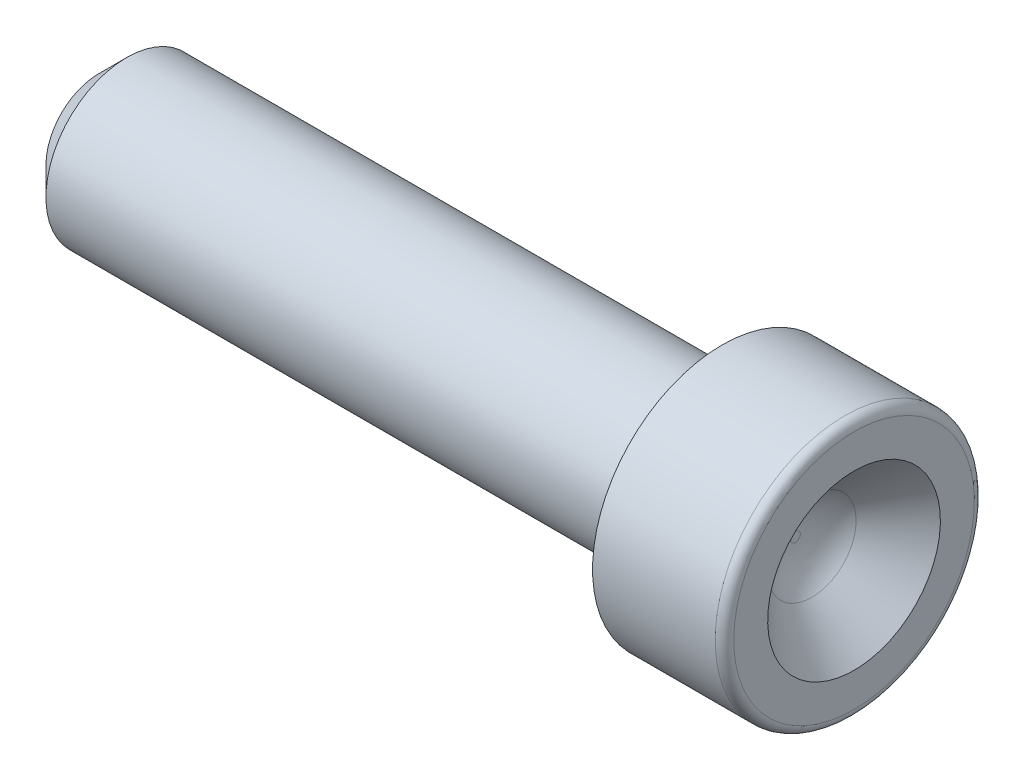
SolidWorks part; units mm, degrees
ref_plane "Front Plane" through (0, 0, 0) normal (0, 0, 1) x (1, 0, 0)
ref_plane "Top Plane" through (0, 0, 0) normal (0, 1, 0) x (1, 0, 0)
ref_plane "Right Plane" through (0, 0, 0) normal (1, 0, 0) x (0, 0, -1)
sketch "Sketch1" plane through (0, 0, 0) normal (0, 0, 1) x (1, 0, 0)
  line L0 (20.65, -1.333) -> (17.043, -1.333)
  line L1 (17.043, -1.333) -> (17.043, 0)
  line L2 (0, 0) -> (17.043, 0)
  line L3 (19.05, 1.448) -> (20.65, -0.152)
  line L4 (20.65, -0.152) -> (20.65, -1.333)
  line L5 (19.05, 1.448) -> (19.05, 2.21)
  line L6 (19.05, 2.21) -> (0, 2.21)
  line L7 (0, 2.21) -> (0, 0)
other "AlignGroup1" parameters "D1"=33.4281, "D2"=10.0332, "D3"=23.8772, "D4"=12.4055, "D5"=10.7691, "D6"=5.9816, "D7"=4.2296, "D8"=1.333
revolve "Revolve1" add sketch "Sketch1" angle 360 about L6
fillet "Fillet1" radius 0.508 1 edges at (17.043, 4.42, 0)
chamfer "Chamfer1" distance 0.762 angle 45 1 edges at (0, 4.42, 0)
fillet "Fillet2" radius 1.524 1 edges at (19.05, 2.972, 0)
fillet "Fillet3" radius 0.254 1 edges at (20.65, 5.753, 0)
